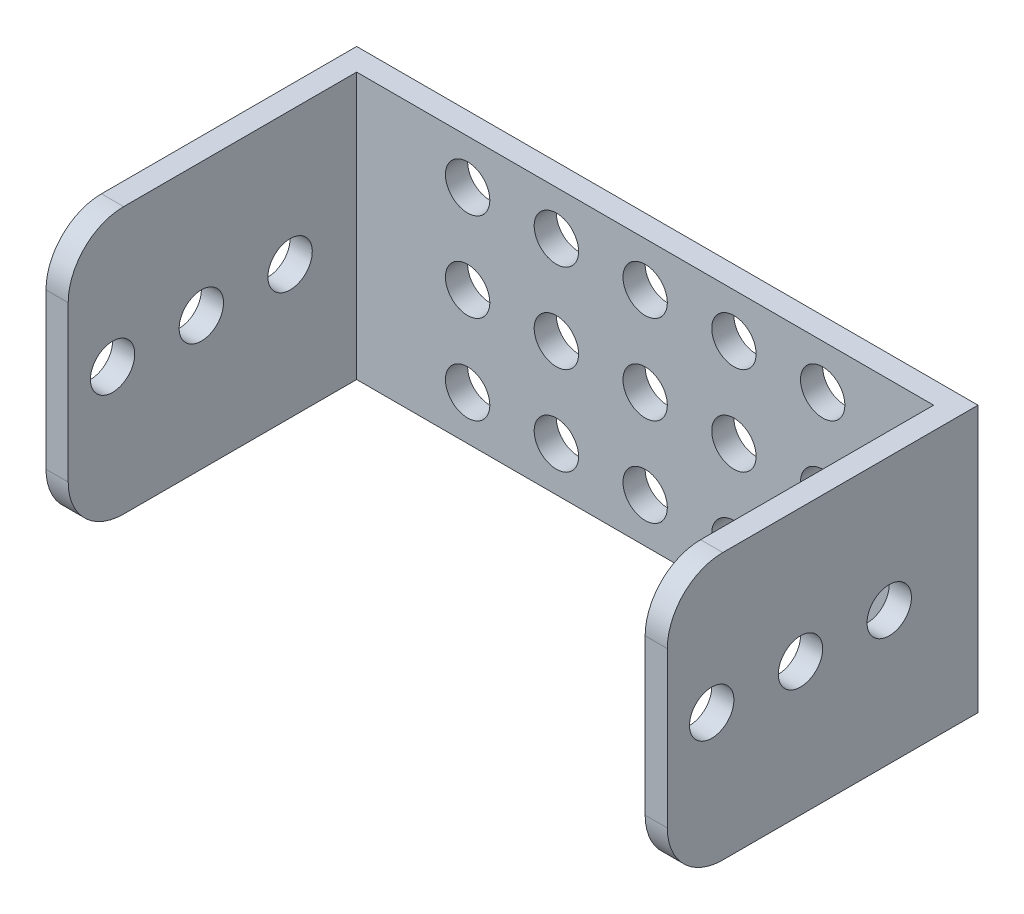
SolidWorks part; units mm, degrees
ref_plane "前视基准面" through (0, 0, 0) normal (0, 0, 1) x (1, 0, 0)
ref_plane "上视基准面" through (0, 0, 0) normal (0, 1, 0) x (1, 0, 0)
ref_plane "右视基准面" through (0, 0, 0) normal (1, 0, 0) x (0, 0, -1)
sketch "草图1" plane through (0, 0, 0) normal (0, 0, 1) x (1, 0, 0)
  line L1 (-28, 12) -> (28, 12)
  line L2 (-28, 12) -> (-28, -12)
  line L3 (-28, -12) -> (28, -12)
  line L4 (28, 12) -> (28, -12)
  line L5 (-28, 12) -> (28, -12) construction
  line L6 (-28, -12) -> (28, 12) construction
  point P0 (0, 0)
  dimension "D1" = 56
  dimension "D2" = 24
extrude "凸台-拉伸1" add sketch "草图1" along normal blind 2
sketch "草图2" plane through (0, 0, 2) normal (0, 0, 1) x (1, 0, 0)
  line L0 (-28, -12) -> (28, -12) construction
  line L1 (-28, 12) -> (-26, 12)
  line L2 (-28, 12) -> (-28, -12)
  line L3 (-28, -12) -> (-26, -12)
  line L4 (-26, 12) -> (-26, -12)
  line L6 (28, 12) -> (26, 12)
  line L7 (28, 12) -> (28, -12)
  line L8 (28, -12) -> (26, -12)
  line L9 (26, 12) -> (26, -12)
  dimension "D1" = 2
  dimension "D2" = 2
extrude "凸台-拉伸2" add sketch "草图2" along normal blind 26
hole_wizard "Ø4.0 (4) 直径孔1" positions "草图3" profile "草图4" hole size "Ø4.0" standard "GB"
sketch "草图3" plane through (0, 0, 2) normal (0, 0, 1) x (1, 0, 0)
  point P0 (0, 8)
  point P2 (0, 0)
  point P5 (0, -8)
  dimension "D1" = 8
  dimension "D2" = 8
sketch "草图4" plane through (0, 8, 2) normal (1, 0, 0) x (0, -1, 0)
  line L0 (0, 0) -> (0, 2)
  line L1 (0, 2) -> (2, 2)
  line L2 (2, 2) -> (2, 0)
  line L5 (2, 0) -> (0, 0)
  line L11 (0, -6.35) -> (0, 107.95) construction
  dimension "通孔孔直径" = 4
  dimension "通孔孔深度" = 2
pattern_linear "阵列(线性)1" count 3 spacing 8 along (1, 0, 0) of "Ø4.0 (4) 直径孔1"
pattern_linear "阵列(线性)2" count 3 spacing 8 along (-1, 0, 0) of "Ø4.0 (4) 直径孔1"
fillet "圆角1" radius 5 4 edges at (27, -12, 28) (27, 12, 28) (-27, -12, 28) (-27, 12, 28)
hole_wizard "Ø4.0 (4) 直径孔2" positions "草图5" profile "草图6" hole size "Ø4.0" standard "GB"
sketch "草图5" plane through (-28, 0, 0) normal (-1, 0, 0) x (0, 0, 1)
  line L0 (0, 12) -> (0, -12) construction
  point P0 (24, 0)
  point P2 (16, 0)
  point P4 (8, 0)
  dimension "D1" = 16
  dimension "D2" = 16
  dimension "D3" = 8
sketch "草图6" plane through (-28, 0, 24) normal (0, 1, 0) x (0, 0, 1)
  line L0 (0, 0) -> (0, 56)
  line L1 (0, 56) -> (2, 56)
  line L2 (2, 56) -> (2, 0)
  line L5 (2, 0) -> (0, 0)
  line L11 (0, -6.35) -> (0, 107.95) construction
  dimension "通孔孔直径" = 4
  dimension "通孔孔深度" = 56
